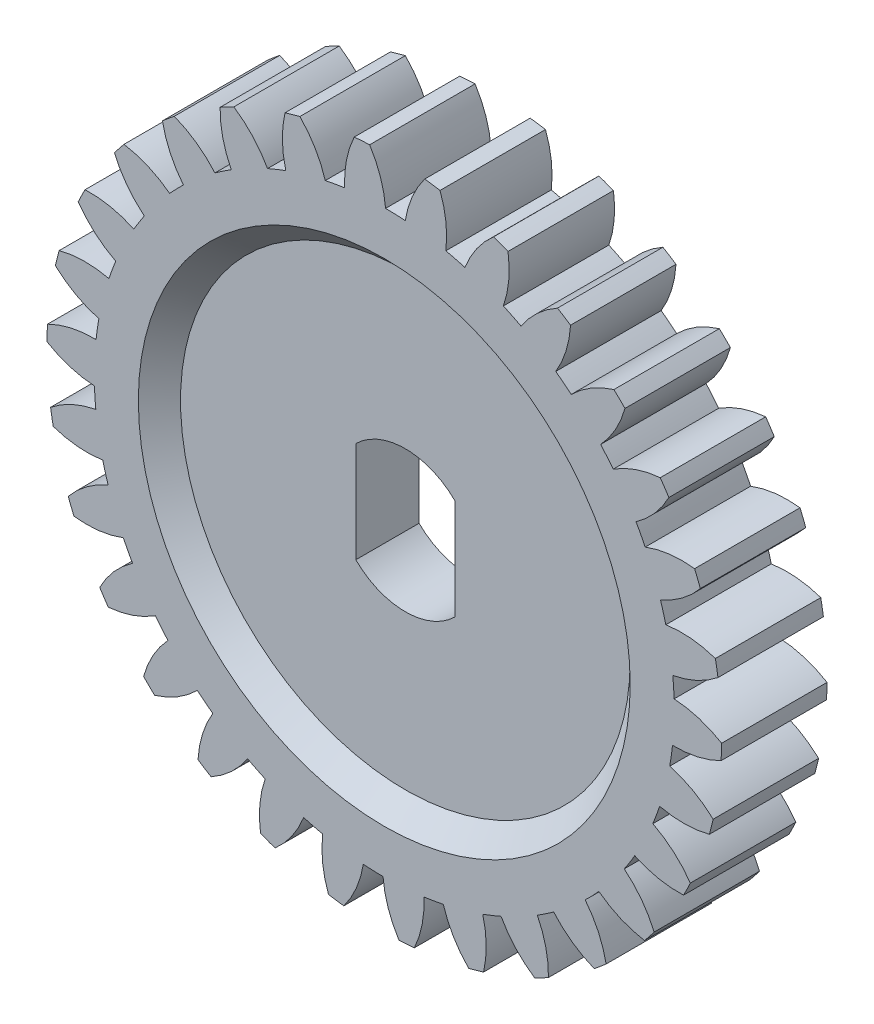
SolidWorks part; units mm, degrees
ref_plane "Front Plane" through (0, 0, 0) normal (0, 0, 1) x (1, 0, 0)
ref_plane "Top Plane" through (0, 0, 0) normal (0, 1, 0) x (1, 0, 0)
ref_plane "Right Plane" through (0, 0, 0) normal (1, 0, 0) x (0, 0, -1)
sketch "Root Circle" plane through (0, 0, 0) normal (0, 0, 1) x (1, 0, 0)
  circle A0 centre (0, 0) radius 13.75
extrude "Root Circle Thickness" add sketch "Root Circle" along normal blind 5
sketch "Sketch3" plane through (0, 0, 5) normal (0, 0, 1) x (1, 0, 0)
  line L0 (0, 0) -> (13.75, 0) construction
  line L1 (13.75, 0) -> (16.1667, 0) construction
  line L2 (0, 0) -> (13.2453, 4.8209) construction
  line L3 (13.2453, 4.8209) -> (15, 0) construction
  line L4 (15.5318, 0) -> (12.7918, -5.9202) construction
  line L5 (14.9985, 0.2098) -> (14.989, -0.5755) construction
  line L6 (0, 0) -> (14.989, -0.5755) construction
  circle A0 centre (0, 0) radius 14.0954 construction
  circle A1 centre (0, 0) radius 15 construction
  arc A2 (15.9699, -0.9803) -> (15.9981, -0.2472) centre (0, 0) ccw
  circle A3 centre (0, 0) radius 13.75 construction
  arc A4 (15.9981, -0.2472) -> (13.7428, 0.4452) centre (13.4768, -4.4402) ccw
  arc A5 (13.6682, -1.4977) -> (13.7428, 0.4452) centre (0, 0) ccw
  arc A6 (15.9699, -0.9803) -> (13.6682, -1.4977) centre (13.7776, 3.3937) cw
  point P10 (15.5318, 0)
  point P15 (13.4768, -4.4402)
extrude "Extrude3" add sketch "Sketch3" against normal blind 5
pattern_circular "CirPattern1" count 30 over 360 about axis through (0, 0, 0) along (0, 0, 1) of "Extrude3"
sketch "Sketch4" plane through (0, 0, 5) normal (0, 0, 1) x (1, 0, 0)
  line L0 (0, 3.35) -> (0, -3.35) construction
  line L1 (-2.35, 2.3875) -> (-2.35, -2.3875)
  line L3 (2.35, 2.3875) -> (2.35, -2.3875)
  line L4 (-2.35, 3.35) -> (-2.35, -3.35) construction
  line L5 (2.35, 3.35) -> (2.35, -3.35) construction
  arc A0 (-2.35, -2.3875) -> (2.35, -2.3875) centre (0, 0) ccw
  arc A1 (2.35, 2.3875) -> (-2.35, 2.3875) centre (0, 0) ccw
  dimension "D1" = 6.7
  dimension "D2" = 2.35
  dimension "D3" = 2.35
extrude "Extrude4" cut sketch "Sketch4" against normal blind 13
sketch "Sketch5" plane through (0, 0, 5) normal (0, 0, 1) x (1, 0, 0)
  circle A1 centre (0, 0) radius 10.6633
extrude "Extrude5" cut sketch "Sketch5" against normal blind 1
chamfer "Chamfer1" distance 1 angle 45 1 edges at (10.6633, 0, 5)
ref_plane "Plane1" through (0, 0, 2.5) normal (0, 0, 1) x (1, 0, 0)
mirror "Mirror6" about plane through (0, 0, 2.5) normal (0, 0, 1) of "Extrude5"
chamfer "Chamfer2" distance 1 angle 45 1 edges at (10.6633, 0, 0)
equation "\"m\"=1"
equation "\"t\"=30"
equation "\"phi\"=20 ' Pressure Angle"
equation "\"a\"=\"m\" ' Addendum"
equation "\"d\"=1.25*\"a\" ' Dedendum"
equation "\"PCD\"=\"m\"*\"t\" ' Pitch Circle Diameter"
equation "\"TCD\"=\"PCD\"+(2*\"a\") ' Tip Circle Diameter"
equation "\"BCD\"=\"PCD\"* cos( \"phi\")  ' Base Circle Diameter"
equation "\"RCD\"=\"PCD\"-(2*\"d\") ' Root Circle Diameter"
equation "\"P\"= pi *\"m\" ' Circular Pitch"
equation "\"PA\"=360/\"t\" ' Pitch Angle"
equation "\"CTT\"=(pi*\"m\")/4"
equation "\"FR\"=0.3/\"P\" ' Fillet Radius"
equation "\"PC\"=(\"TCD\"-\"BCD\")/6 ' Point C Distance"
equation "\"DpD\"= \"D1@Sketch3\""
equation "\"D2@Sketch3\" = \"DpD\"/4"
